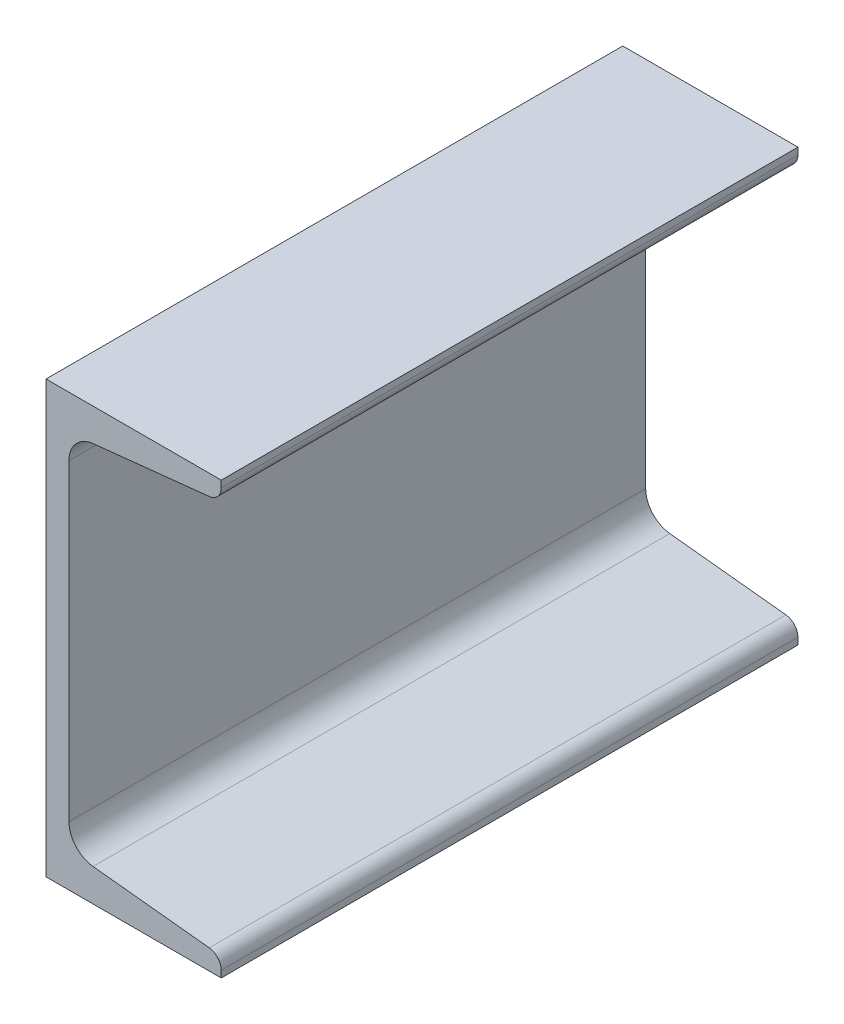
SolidWorks part; units mm, degrees
ref_plane "前视基准面" through (0, 0, 0) normal (0, 0, 1) x (1, 0, 0)
ref_plane "上视基准面" through (0, 0, 0) normal (0, 1, 0) x (1, 0, 0)
ref_plane "右视基准面" through (0, 0, 0) normal (1, 0, 0) x (0, 0, -1)
sketch "草图1" plane through (0, 0, 0) normal (0, 0, 1) x (1, 0, 0)
  line L0 (0, 80) -> (0, -80)
  line L1 (0, -80) -> (65, -80)
  line L2 (65, -80) -> (65, -77.4971)
  line L3 (60.528, -72.5251) -> (17.444, -67.9498)
  line L4 (8.5, -58.0057) -> (8.5, 58.0057)
  line L5 (17.444, 67.9498) -> (60.528, 72.5251)
  line L6 (65, 77.4971) -> (65, 80)
  line L7 (65, 80) -> (0, 80)
  line L8 (36.75, 80) -> (36.75, 70) construction
  line L9 (36.75, -70) -> (36.75, -80) construction
  arc A0 (8.5, 58.0057) -> (17.444, 67.9498) centre (18.5, 58.0057) cw
  arc A1 (17.444, -67.9498) -> (8.5, -58.0057) centre (18.5, -58.0057) cw
  arc A2 (60.528, 72.5251) -> (65, 77.4971) centre (60, 77.4971) ccw
  arc A3 (65, -77.4971) -> (60.528, -72.5251) centre (60, -77.4971) ccw
  point P19 (65, 73)
  point P22 (65, -73)
  dimension "D11" = 10
  dimension "D12" = 5
  dimension "D1" = 160
  dimension "D2" = 65
  dimension "D3" = 80
  dimension "D4" = 65
  dimension "D5" = 7
  dimension "D6" = 7
  dimension "D7" = 8.5
  dimension "D8" = 28.25
  dimension "D9" = 10
  dimension "D10" = 10
extrude "拉伸1" add sketch "草图1" along normal blind 214
